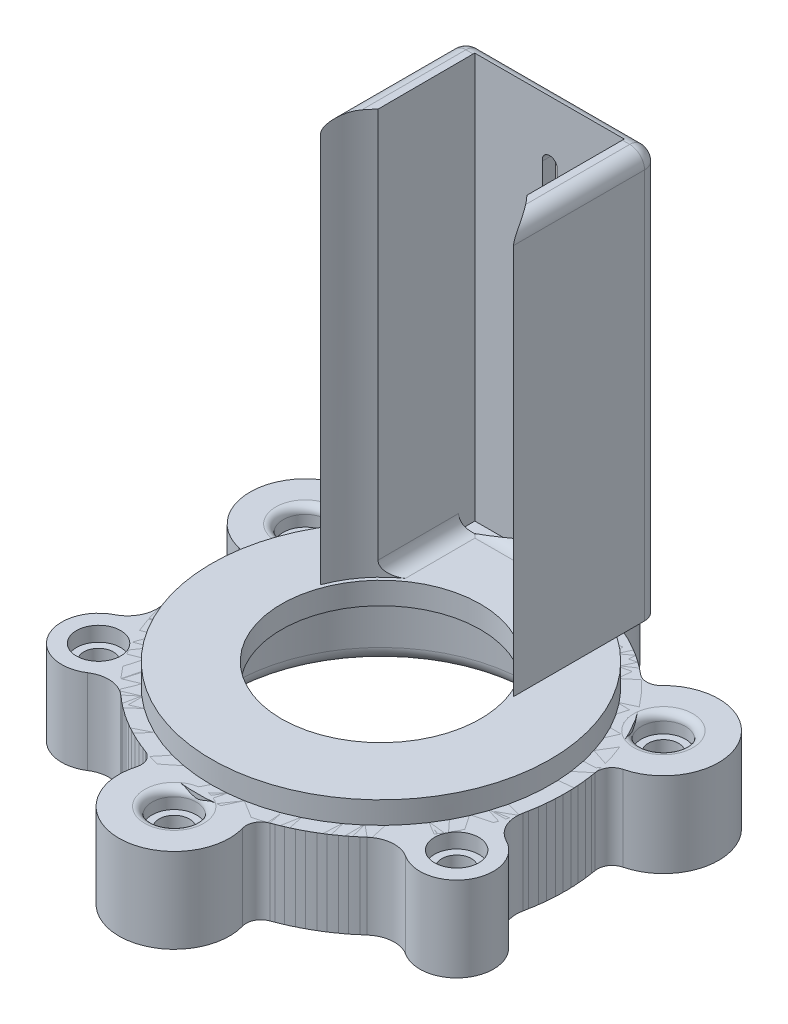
SolidWorks part; units mm, degrees
ref_plane "Front Plane" through (0, 0, 0) normal (0, 0, 1) x (1, 0, 0)
ref_plane "Top Plane" through (0, 0, 0) normal (0, 1, 0) x (1, 0, 0)
ref_plane "Right Plane" through (0, 0, 0) normal (1, 0, 0) x (0, 0, -1)
ref_plane "Plane1"
sketch "Sketch1" plane through (0, 0, 0) normal (0, 1, 0) x (-1, 0, 0)
  arc A0 (7.2048, 25.9665) -> (8.4501, 23.5286) centre (9.1261, 25.4109) ccw
  arc A1 (7.2048, 25.9665) -> (-7.2048, 25.9665) centre (0, 28.05) ccw
  arc A2 (-8.4501, 23.5286) -> (-7.2048, 25.9665) centre (-9.1261, 25.4109) ccw
  arc A3 (-8.4501, 23.5286) -> (-24.6014, -4.4463) centre (0, 0) ccw
  arc A4 (-26.0901, -6.7437) -> (-24.6014, -4.4463) centre (-26.5695, -4.802) ccw
  arc A5 (-26.0901, -6.7437) -> (-18.8853, -19.2228) centre (-24.292, -14.025) ccw
  arc A6 (-16.1514, -19.0823) -> (-18.8853, -19.2228) centre (-17.4435, -20.6089) ccw
  arc A7 (-16.1514, -19.0823) -> (16.1514, -19.0823) centre (0, 0) ccw
  arc A8 (18.8853, -19.2228) -> (16.1514, -19.0823) centre (17.4435, -20.6089) ccw
  arc A9 (18.8853, -19.2228) -> (26.0901, -6.7437) centre (24.292, -14.025) ccw
  arc A10 (24.6014, -4.4463) -> (26.0901, -6.7437) centre (26.5695, -4.802) ccw
  arc A11 (24.6014, -4.4463) -> (8.4501, 23.5286) centre (0, 0) ccw
  circle A12 centre (0, 28.05) radius 2.05
  circle A13 centre (-24.292, -14.025) radius 2.05
  circle A14 centre (24.292, -14.025) radius 2.05
  circle A15 centre (0, 0) radius 20
  dimension "D1" = 40
  dimension "D2" = 2
extrude "Extrusion1" add sketch "Sketch1" along normal blind 11.5 contours A10 A11 A0 A1 A2 A3 A4 A5 A6 A7 A8 A9 A15 A14 A13 A12
fillet "Fillet1" radius 2 1 edges at (0, 0, 20)
ref_plane "Plane2" through (0, 11.5, 0) normal (0, 1, 0) x (1, 0, 0)
sketch "Sketch2" plane through (0, 11.5, 0) normal (0, 1, 0) x (1, 0, 0)
  circle A0 centre (0, 0) radius 23
  circle A1 centre (0, 0) radius 13.5
  dimension "D1" = 27
  dimension "D2" = 46
extrude "Extrusion2" add sketch "Sketch2" along normal blind 3 contours A0 A1
ref_plane "Plane3" through (0, 14.5, 0) normal (0, 1, 0) x (1, 0, 0)
sketch "Sketch3" plane through (0, 14.5, 0) normal (0, 1, 0) x (1, 0, 0)
  line L0 (10.1269, 22.9071) -> (10.1269, 9.6667)
  line L1 (13.1269, 4.8666) -> (13.1269, 24.6291)
  line L2 (13.1269, 24.6291) -> (-13.1089, 24.6291)
  line L3 (-13.1089, 24.6291) -> (-13.1089, 4.9151)
  line L4 (-10.0944, 9.7007) -> (-10.1269, 22.8571)
  line L5 (-10.1269, 22.8571) -> (10.1269, 22.9071)
  arc A0 (13.1269, 4.8666) -> (10.1269, 9.6667) centre (0, 0) ccw
  arc A1 (-10.0944, 9.7007) -> (-13.1089, 4.9151) centre (0, 0) ccw
extrude "Extrusion3" add sketch "Sketch3" along normal blind 55
sketch "Sketch4" plane through (0, 0, -24.6291) normal (0, 0, -1) x (-1, 0, 0)
  line L0 (0.9822, 61.3676) -> (0.9822, 23.8669)
  line L1 (-1.009, 23.7347) -> (-1, 61.366)
  arc A0 (0.9822, 61.3676) -> (-1, 61.366) centre (-0.009, 61.5) ccw
  arc A1 (-1.009, 23.7347) -> (0.9822, 23.8669) centre (-0.009, 23.7344) ccw
  dimension "D1" = 2
  dimension "D2" = 2
extrude "Extrusion4" sketch "Sketch4" blind 55
ref_plane "Plane4" through (0, 14.5, 0) normal (0, 1, 0) x (1, 0, 0)
sketch "Sketch5" plane through (0, 14.5, 0) normal (0, 1, 0) x (1, 0, 0)
  line L0 (-10.1269, 22.8571) -> (-10.1215, 20.6532)
  line L1 (-2.3831, 22.8762) -> (-10.1269, 22.8571)
  line L2 (10.1269, 22.8571) -> (2.3831, 22.8762)
  line L3 (10.1215, 20.6532) -> (10.1269, 22.8571)
  arc A0 (-2.3831, 22.8762) -> (-10.1215, 20.6532) centre (0, 0) ccw
  arc A1 (10.1215, 20.6532) -> (2.3831, 22.8762) centre (0, 0) ccw
extrude "Extrusion5" add sketch "Sketch5" against normal blind 4 separate body contours A0 L1 L0 | A1 L3 L2
fillet "Fillet3" radius 2 1 edges at (-0.0566, 14.5, -22.882)
fillet "Fillet9" radius 2 1 edges at (-10.1079, 14.5, -15.177)
fillet "Fillet10" radius 2 5 edges at (-13.1089, 69.5, -14.7721) (13.1269, 69.5, -14.7479) (0.009, 69.5, -24.6291) (-13.1089, 42, -24.6291) (13.1269, 42, -24.6291)
ref_plane "Plane5" through (24.292, 11.5, -14.025) normal (0, 1, 0) x (0, 0, -1)
hole_wizard "Hole2" positions "Sketch7" profile "Sketch6" legacy
sketch "Sketch7" plane through (24.292, 11.5, -14.025) normal (0, 1, 0) x (0, 0, -1)
  point P1 (0, 0)
  point P2 (-42.075, 24.292)
  point P3 (0, 48.584)
sketch "Sketch6" plane through (24.292, 11.5, -14.025) normal (1, 0, 0) x (0, 0, 1)
  line L0 (0, 0) -> (0, 11.5)
  line L1 (0, 11.5) -> (2, 11.5)
  line L2 (2, 11.5) -> (2, 2.5)
  line L3 (2, 2.5) -> (3, 2.5)
  line L4 (3, 2.5) -> (3, 0)
  line L5 (3, 0) -> (0, 0)
  line L6 (0, 110) -> (0, -10) construction
  dimension "Diameter" = 4
  dimension "Depth" = 11.5
  dimension "C-Bore Diameter" = 6
  dimension "C-Bore Depth" = 2.5
fillet "Fillet12" radius 1 3 edges at (24.292, 11.5, -11.025) (0, 11.5, 31.05) (-24.292, 11.5, -11.025)
ref_plane "Plane6" through (0, 11.5, 0) normal (0, 1, 0) x (1, 0, 0)
sketch "Sketch8" plane through (0, 11.5, 0) normal (0, 1, 0) x (1, 0, 0)
  arc A0 (-26.5586, -9.5683) -> (-24.4585, -5.1749) centre (-28.3719, -6.0029) ccw
  arc A1 (-7.7477, 23.7692) -> (-24.4585, -5.1749) centre (0, 0) ccw
  arc A2 (-7.7477, 23.7692) -> (-4.993, 27.7846) centre (-8.9873, 27.5722) ccw
  arc A3 (4.993, 27.7846) -> (-4.993, 27.7846) centre (0, 28.05) ccw
  arc A4 (4.993, 27.7846) -> (7.7477, 23.7692) centre (8.9873, 27.5722) ccw
  arc A5 (24.4585, -5.1749) -> (7.7477, 23.7692) centre (0, 0) ccw
  arc A6 (24.4585, -5.1749) -> (26.5586, -9.5683) centre (28.3719, -6.0029) ccw
  arc A7 (21.5657, -18.2163) -> (26.5586, -9.5683) centre (24.292, -14.025) ccw
  arc A8 (21.5657, -18.2163) -> (16.7109, -18.5943) centre (19.3846, -21.5694) ccw
  arc A9 (-16.7109, -18.5943) -> (16.7109, -18.5943) centre (0, 0) ccw
  arc A10 (-16.7109, -18.5943) -> (-21.5657, -18.2163) centre (-19.3846, -21.5694) ccw
  arc A11 (-26.5586, -9.5683) -> (-21.5657, -18.2163) centre (-24.292, -14.025) ccw
  circle A12 centre (-24.292, -14.025) radius 2
  circle A13 centre (0, 28.05) radius 2
  circle A14 centre (24.292, -14.025) radius 2
  circle A15 centre (0, 0) radius 22.8583
  dimension "D1" = 4
  dimension "D2" = 4
  dimension "D3" = 4
  dimension "D4" = 10
  dimension "D5" = 10
  dimension "D6" = 10
  dimension "D7" = 4
extrude "Extrusion6" add sketch "Sketch8" against normal blind 11.5 separate body contours A0 A11 A10 A9 A8 A7 A6 A5 A4 A3 A2 A1 A15 A14 A13 A12
ref_plane "Plane7" through (0, 11.5, 0) normal (0, 1, 0) x (1, 0, 0)
sketch "Sketch9" plane through (0, 11.5, 0) normal (0, 1, 0) x (1, 0, 0)
  circle A0 centre (24.292, -14.025) radius 3
  circle A1 centre (-24.292, -14.025) radius 3
  circle A2 centre (0, 28.05) radius 3
  circle A3 centre (24.292, -14.025) radius 2
  circle A4 centre (-24.292, -14.025) radius 2
  circle A5 centre (0, 28.05) radius 2
  dimension "D1" = 6
  dimension "D2" = 6
  dimension "D3" = 6
extrude "Extrusion7" sketch "Sketch9" blind 2 contours A0 A3 | A1 A4 | A2 A5
